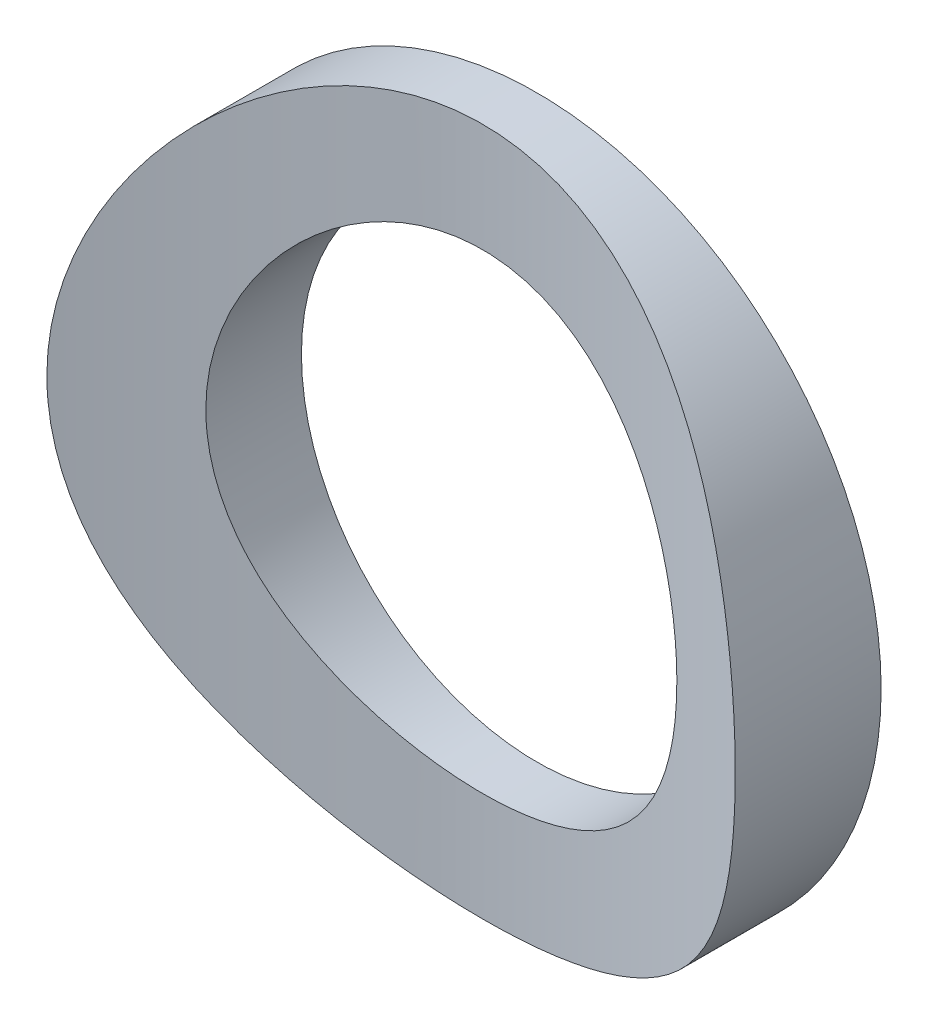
SolidWorks part; units mm, degrees
ref_plane "Plan1" through (0, 0, 0) normal (0, 0, 1) x (1, 0, 0)
ref_plane "Plan2" through (0, 0, 0) normal (0, 1, 0) x (1, 0, 0)
ref_plane "Plan3" through (0, 0, 0) normal (1, 0, 0) x (0, 0, -1)
sketch "Esquisse2" plane through (0, 0, 0) normal (0, 0, 1) x (1, 0, 0)
  circle A0 centre (0, 0) radius 19
  circle A1 centre (0, 0) radius 13
  dimension "D1" = 38
  dimension "D2" = 26
extrude "Base-Extrusion" add sketch "Esquisse2" along normal blind 10
sketch "Esquisse3" plane through (0, 0, 0) normal (0, 1, 0) x (1, 0, 0)
  line L0 (19, 0) -> (-19, 0) construction
  circle A0 centre (0, -41.25) radius 38.25
  dimension "D2" = 76.5
  dimension "D1" = 41.25
extrude "Enlèv. mat.-Extru.1" cut sketch "Esquisse3" against normal mid plane 100
